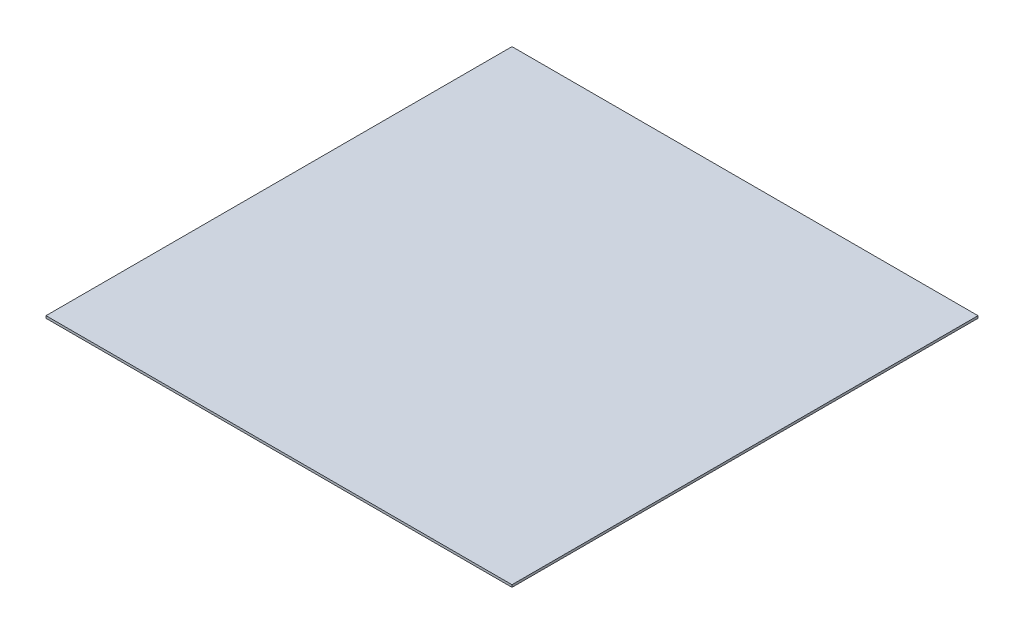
SolidWorks part; units mm, degrees
ref_plane "Front Plane" through (0, 0, 0) normal (0, 0, 1) x (1, 0, 0)
ref_plane "Top Plane" through (0, 0, 0) normal (0, 1, 0) x (1, 0, 0)
ref_plane "Right Plane" through (0, 0, 0) normal (1, 0, 0) x (0, 0, -1)
sketch "Sketch1" plane through (0, 0, 0) normal (0, 1, 0) x (1, 0, 0)
  line L1 (-100, -100) -> (100, -100)
  line L2 (-100, -100) -> (-100, 100)
  line L3 (-100, 100) -> (100, 100)
  line L4 (100, -100) -> (100, 100)
  line L5 (-100, -100) -> (100, 100) construction
  line L6 (-100, 100) -> (100, -100) construction
  point P0 (0, 0)
  dimension "D1" = 200
  dimension "D2" = 200
extrude "Boss-Extrude1" add sketch "Sketch1" along normal blind 1
